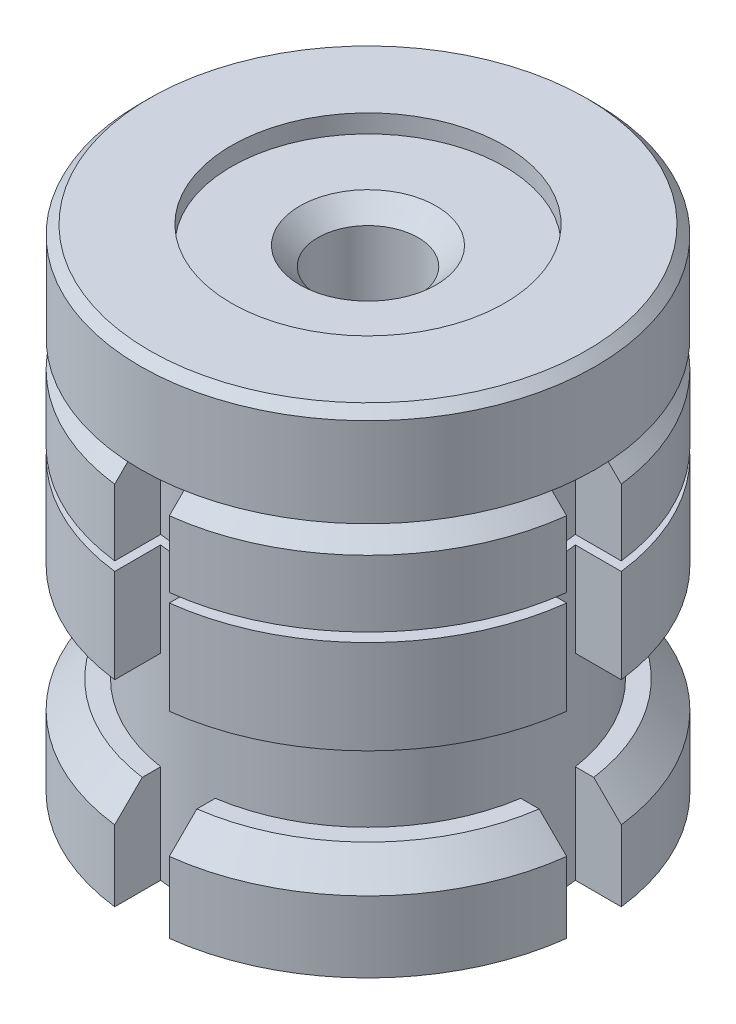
SolidWorks part; units mm, degrees
ref_plane "Front Plane" through (0, 0, 0) normal (0, 0, 1) x (1, 0, 0)
ref_plane "Top Plane" through (0, 0, 0) normal (0, 1, 0) x (1, 0, 0)
ref_plane "Right Plane" through (0, 0, 0) normal (1, 0, 0) x (0, 0, -1)
sketch "Sketch1" plane through (0, 0, 0) normal (0, 1, 0) x (1, 0, 0)
  circle A0 centre (0, 0) radius 12.5
  dimension "D1" = 25
extrude "Boss-Extrude1" add sketch "Sketch1" along normal blind 10.8
sketch "Sketch2" plane through (0, 0, 0) normal (1, 0, 0) x (0, 0, -1)
  line L0 (0, 13.2648) -> (0, -2.3994) construction
  line L1 (-12.5, 0) -> (12.5, 0) construction
  line L2 (-12.5, 5.65) -> (-7.5, 5.65)
  line L3 (-12.5, 5.65) -> (-12.5, 5.15)
  line L4 (-12.5, 5.15) -> (-7.5, 5.15)
  line L5 (-7.5, 5.65) -> (-7.5, 5.15)
  line L6 (-12.5, 5.65) -> (-7.5, 5.15) construction
  line L7 (-12.5, 5.15) -> (-7.5, 5.65) construction
  point P3 (-10, 5.4)
  point P8 (-12.5, 5.4)
  dimension "D1" = 0.5
  dimension "D2" = 12.5
  dimension "D3" = 7.5
  dimension "D4" = 5.4
revolve "Cut-Revolve1" cut sketch "Sketch2" angle 360 about L0
sketch "Sketch3" plane through (0, 0, 0) normal (0, -1, 0) x (1, 0, 0)
  circle A0 centre (0, 0) radius 10
  dimension "D1" = 20
extrude "Boss-Extrude2" add sketch "Sketch3" along normal blind 10.8
sketch "Sketch4" plane through (0, -10.8, 0) normal (0, -1, 0) x (1, 0, 0)
  circle A0 centre (0, 0) radius 12.5
  circle A1 centre (0, 0) radius 12.5 construction
extrude "Boss-Extrude3" add sketch "Sketch4" against normal blind 5.4
sketch "Sketch5" plane through (0, 10.8, 0) normal (0, 1, 0) x (1, 0, 0)
  line L0 (-12.4097, 1.5) -> (-9.8869, 1.5)
  line L2 (-9.8869, -1.5) -> (-12.4097, -1.5)
  line L3 (-1.5, 12.4097) -> (-1.5, 9.8869)
  line L5 (1.5, 9.8869) -> (1.5, 12.4097)
  line L6 (9.8869, 1.5) -> (12.4097, 1.5)
  line L8 (12.4097, -1.5) -> (9.8869, -1.5)
  line L9 (-1.5, -9.8869) -> (-1.5, -12.4097)
  line L11 (1.5, -12.4097) -> (1.5, -9.8869)
  arc A0 (-9.8869, 1.5) -> (-9.8869, -1.5) centre (0, 0) ccw
  circle A1 centre (0, 0) radius 10 construction
  arc A2 (-12.4097, 1.5) -> (-12.4097, -1.5) centre (0, 0) ccw
  circle A3 centre (0, 0) radius 12.5 construction
  arc A4 (-1.5, -9.8869) -> (1.5, -9.8869) centre (0, 0) ccw
  arc A5 (-1.5, -12.4097) -> (1.5, -12.4097) centre (0, 0) ccw
  arc A6 (9.8869, -1.5) -> (9.8869, 1.5) centre (0, 0) ccw
  arc A7 (12.4097, -1.5) -> (12.4097, 1.5) centre (0, 0) ccw
  arc A8 (1.5, 9.8869) -> (-1.5, 9.8869) centre (0, 0) ccw
  arc A9 (1.5, 12.4097) -> (-1.5, 12.4097) centre (0, 0) ccw
  point P1 (-12.5, 0)
  point P5 (-10, 0)
  point P25 (0, 0)
  dimension "D1" = 3
extrude "Cut-Extrude4" cut sketch "Sketch5" against normal up to surface (21.6 mm away)
chamfer "Chamfer1" distance 1.5 angle 45 8 edges at (-8.8388, -5.4, -8.8388) (8.8388, -5.4, -8.8388) (-8.8388, 10.8, -8.8388) (8.8388, 10.8, -8.8388) (8.8388, 10.8, 8.8388) (8.8388, -5.4, 8.8388) (-8.8388, -5.4, 8.8388) (-8.8388, 10.8, 8.8388)
sketch "Sketch6" plane through (0, 10.8, 0) normal (0, 1, 0) x (1, 0, 0)
  circle A0 centre (0, 0) radius 12.5
  arc A1 (1.5, -12.4097) -> (12.4097, -1.5) centre (0, 0) ccw construction
extrude "Boss-Extrude4" add sketch "Sketch6" along normal blind 5.4
chamfer "Chamfer2" distance 0.5 angle 45 1 edges at (0, 16.2, 12.5)
sketch "Sketch7" plane through (0, 16.2, 0) normal (0, 1, 0) x (1, 0, 0)
  circle A0 centre (0, 0) radius 7.5
  dimension "D1" = 15
extrude "Cut-Extrude5" cut sketch "Sketch7" against normal blind 1
sketch "Sketch8" plane through (0, 15.2, 0) normal (0, 1, 0) x (1, 0, 0)
  circle A0 centre (0, 0) radius 2.75
  dimension "D1" = 5.5
extrude "Cut-Extrude6" cut sketch "Sketch8" against normal up to surface (26 mm away)
chamfer "Chamfer3" distance 1 angle 45 2 edges at (0, 15.2, 2.75) (0, -10.8, -2.75)
